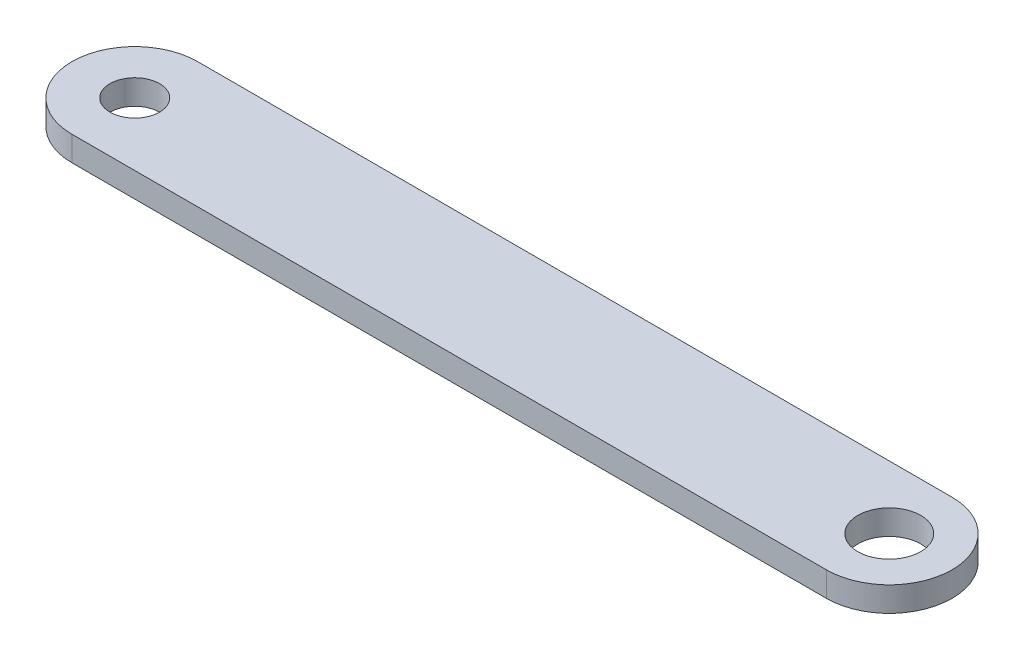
SolidWorks part; units mm, degrees
ref_plane "Front Plane" through (0, 0, 0) normal (0, 0, 1) x (1, 0, 0)
ref_plane "Top Plane" through (0, 0, 0) normal (0, 1, 0) x (1, 0, 0)
ref_plane "Right Plane" through (0, 0, 0) normal (1, 0, 0) x (0, 0, -1)
sketch "Sketch1" plane through (0, 0, 0) normal (0, 1, 0) x (1, 0, 0)
  line L0 (-73.5542, 11.3771) -> (78.8458, 11.3771)
  line L1 (-73.5542, -14.0229) -> (78.8458, -14.0229)
  arc A0 (-73.5542, -14.0229) -> (-73.5542, 11.3771) centre (-73.5542, -1.3229) cw
  arc A1 (78.8458, 11.3771) -> (78.8458, -14.0229) centre (78.8458, -1.3229) cw
  dimension "D2" = 12.7
  dimension "D1" = 152.4
extrude "Boss-Extrude1" add sketch "Sketch1" along normal blind 5
ref_point "Point3"
ref_point "Point4"
sketch "Sketch2" plane through (0, 0, 0) normal (0, 1, 0) x (1, 0, 0)
  circle A0 centre (-73.5542, -1.3229) radius 5
  circle A1 centre (78.8458, -1.3229) radius 5
  dimension "D1" = 10
  dimension "D2" = 10
extrude "Cut-Extrude1" cut sketch "Sketch2" along normal blind 5
sketch "Sketch4" plane through (0, 0, 0) normal (0, -1, 0) x (1, 0, 0)
  circle A0 centre (78.8458, 1.3229) radius 6.35
  dimension "D1" = 12.7
extrude "Cut-Extrude2" cut sketch "Sketch4" against normal through all
